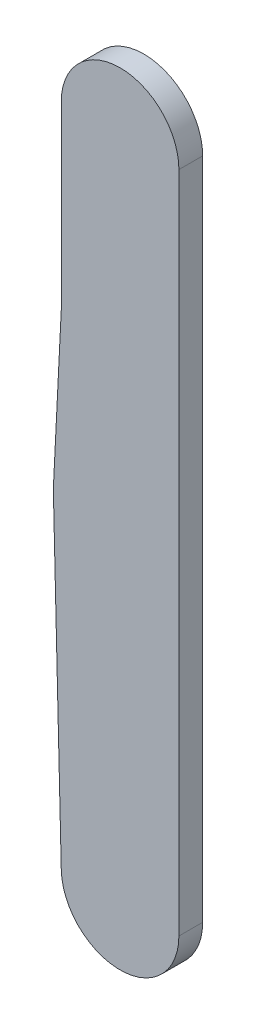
SolidWorks part; units mm, degrees
ref_plane "Face" through (0, 0, 0) normal (0, 0, 1) x (1, 0, 0)
ref_plane "Dessus" through (0, 0, 0) normal (0, 1, 0) x (1, 0, 0)
ref_plane "Droite" through (0, 0, 0) normal (1, 0, 0) x (0, 0, -1)
sketch "Esquisse1" plane through (0, 0, 0) normal (0, 0, 1) x (1, 0, 0)
  line L0 (0, 0) -> (0, -419) construction
  line L1 (-37.13, 0) -> (-37.13, -114)
  line L2 (37.13, 0) -> (37.13, -419)
  line L3 (-70.333, -214) -> (77.6317, -214) construction
  line L5 (-42.13, -214) -> (-37.119, -419.9034)
  line L6 (-81.7621, -114) -> (94.0705, -114) construction
  line L7 (-37.13, -114) -> (-42.13, -214)
  arc A0 (37.13, 0) -> (-37.13, 0) centre (0, 0) ccw
  arc A1 (-37.119, -419.9034) -> (37.13, -419) centre (0, -419) ccw
  dimension "D2" = 74.26
  dimension "D1" = 419
  dimension "D3" = 214
  dimension "D4" = 42.13
  dimension "D5" = 114
extrude "Extrusion1" add sketch "Esquisse1" along normal blind 15
sketch "Esquisse2" plane through (0, 0, 15) normal (0, 0, 1) x (1, 0, 0)
  point P0 (0, -419)
  point P1 (0, 0)
